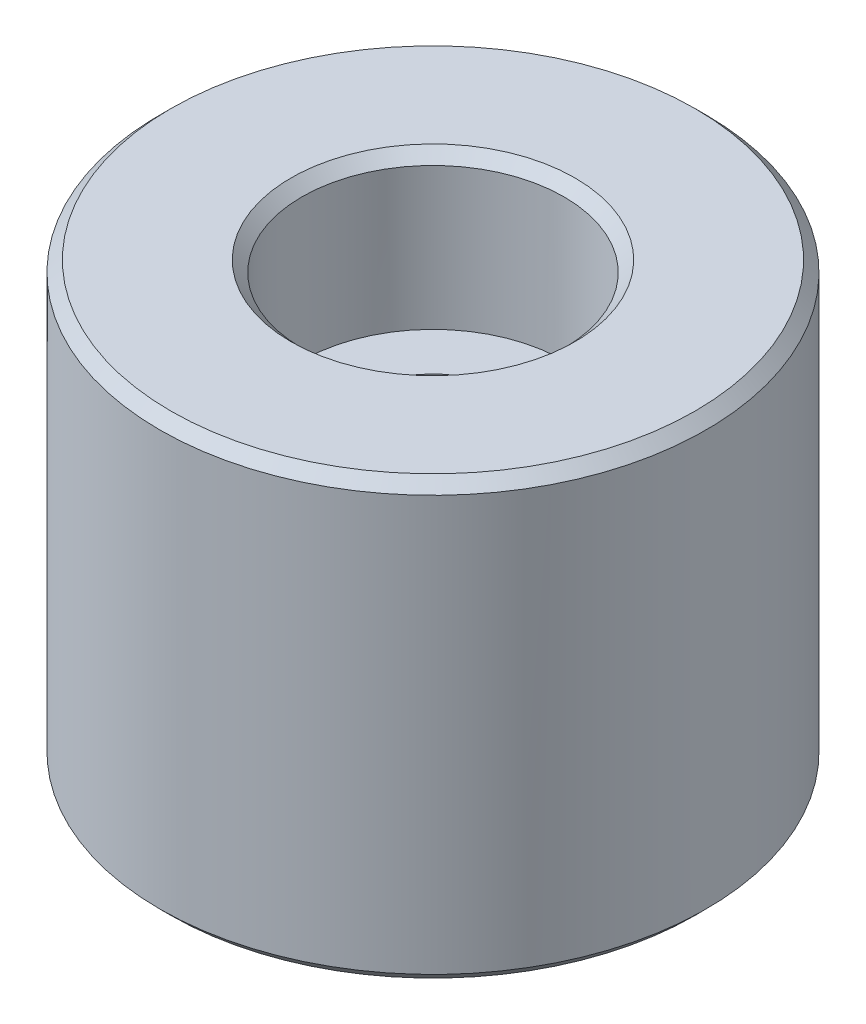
SolidWorks part; units mm, degrees
ref_plane "Plan1" through (0, 0, 0) normal (0, 0, 1) x (1, 0, 0)
ref_plane "Plan2" through (0, 0, 0) normal (0, 1, 0) x (1, 0, 0)
ref_plane "Plan3" through (0, 0, 0) normal (1, 0, 0) x (0, 0, -1)
sketch "Esquisse1" plane through (0, 0, 0) normal (0, 0, 1) x (1, 0, 0)
  line L0 (0, 50) -> (0, -20) construction
  line L1 (12.5, 0) -> (12.5, 20)
  line L2 (12.5, 20) -> (6, 20)
  line L3 (6, 20) -> (6, 13)
  line L4 (3.5, -4) -> (3.5, 13)
  line L5 (3.5, 13) -> (6, 13)
  line L6 (3.5, -4) -> (6, -4)
  line L12 (6, -4) -> (6, 0)
  line L13 (6, 0) -> (12.5, 0)
  dimension "D1" = 3.5
  dimension "D2" = 6
  dimension "D3" = 6
  dimension "D4" = 4
  dimension "D5" = 20
  dimension "D6" = 7
  dimension "D7" = 12.5
revolve "Base-Révolution" add sketch "Esquisse1" angle 360 about L0
chamfer "Chanfrein1" distance 0.5 angle 45 5 edges at (0, -4, 3.5) (0, 20, 6) (0, 20, 12.5) (0, 0, 12.5) (0, -4, 6)
